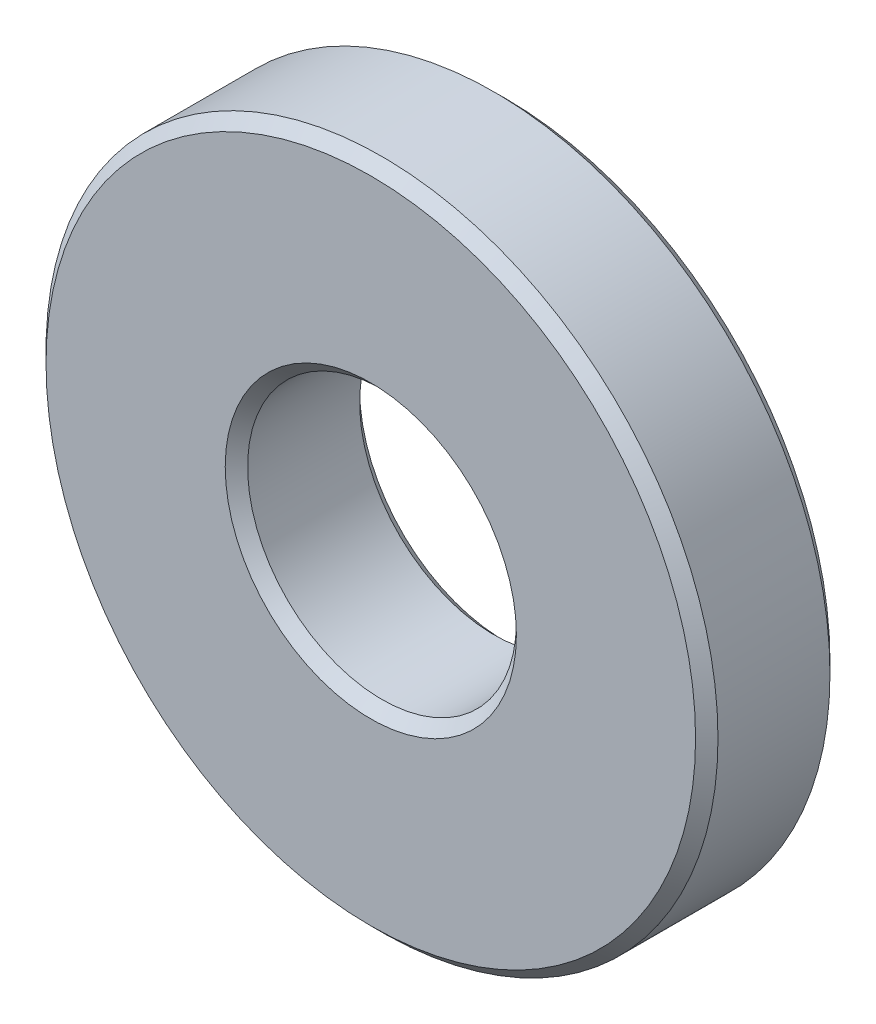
SolidWorks part; units mm, degrees
ref_plane "Спереди" through (0, 0, 0) normal (0, 0, 1) x (1, 0, 0)
ref_plane "Сверху" through (0, 0, 0) normal (0, 1, 0) x (1, 0, 0)
ref_plane "Справа" through (0, 0, 0) normal (1, 0, 0) x (0, 0, -1)
sketch "Эскиз1" plane through (0, 0, 0) normal (0, 0, 1) x (1, 0, 0)
  circle A0 centre (0, 0) radius 3
  circle A1 centre (0, 0) radius 7.5
  dimension "D1" = 15
  dimension "D2" = 6
extrude "Бобышка-Вытянуть1" add sketch "Эскиз1" along normal blind 3
chamfer "Фаска1" distance 0.25 angle 45 4 edges at (7.5, 0, 0) (7.5, 0, 3) (3, 0, 0) (3, 0, 3)
